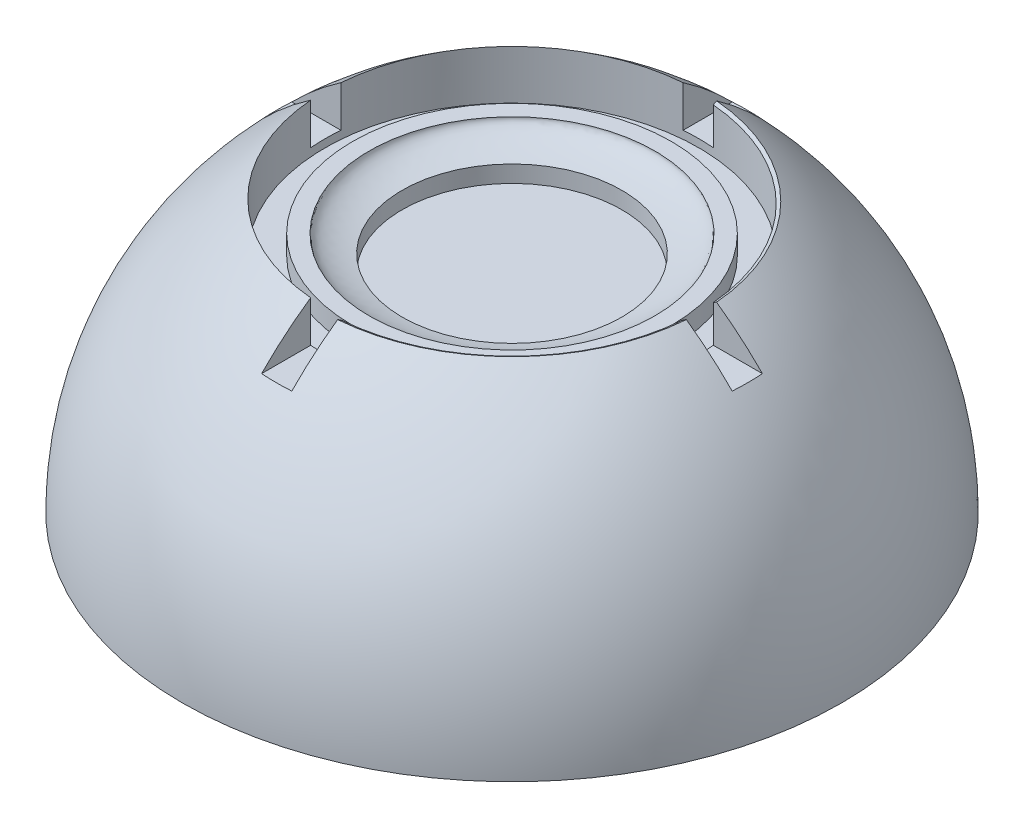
SolidWorks part; units mm, degrees
ref_plane "Front Plane" through (0, 0, 0) normal (0, 0, 1) x (1, 0, 0)
ref_plane "Top Plane" through (0, 0, 0) normal (0, 1, 0) x (1, 0, 0)
ref_plane "Right Plane" through (0, 0, 0) normal (1, 0, 0) x (0, 0, -1)
sketch "Sketch1" plane through (0, 0, 0) normal (0, 0, 1) x (1, 0, 0)
  line L0 (0, 6.1) -> (0, 7.8)
  line L1 (6.1, 0) -> (12, 0)
  line L2 (5.2, 8.8) -> (5.8, 8.8)
  line L3 (0, 12) -> (5.8, 12) construction
  line L4 (0, 9.8) -> (0, 8.8) construction
  line L5 (5.2, 8.8) -> (5.8, 8.8) construction
  line L6 (5.8, 12) -> (5.8, 8.8) construction
  line L7 (5.8, 12) -> (6.8, 12) construction
  line L8 (5.8, 12) -> (5.8, 8.1) construction
  line L9 (5.8, 8.1) -> (6.8, 8.1)
  line L10 (6.8, 12) -> (6.8, 8.1) construction
  line L11 (5.8, 8.8) -> (5.8, 8.1)
  line L12 (6.8, 8.1) -> (6.8, 9.8874)
  line L13 (0, 9.8) -> (0, 12) construction
  line L14 (0, 12) -> (0, 9.8) construction
  line L15 (0, 8.8) -> (5.2, 8.8) construction
  line L16 (0, 8.8) -> (5.2, 8.8) construction
  line L17 (0, 8.8) -> (0, 9.8) construction
  line L18 (0, 7.8) -> (0, 8.8) construction
  arc A1 (12, 0) -> (6.8, 9.8874) centre (0, 0) ccw
  arc A2 (6.1, 0) -> (0, 6.1) centre (0, 0) ccw
  arc A3 (4.677, 11.0511) -> (0, 12) centre (0, 0) ccw construction
  arc A4 (5.8, 10.5052) -> (4.677, 11.0511) centre (0, 0) ccw construction
  arc A5 (6.8, 9.8874) -> (5.8, 10.5052) centre (0, 0) ccw construction
  ellipse E0 centre (0, 8.8) end of major axis (5.2, 8.8) minor radius 1 (0, 9.8) -> (-1.3825, 9.764) ccw construction
  ellipse E1 centre (0, 11.8) end of major axis (5.5, 11.8) minor radius 1.4233 construction
  ellipse E2 centre (0, 8.8) end of major axis (5.2, 8.8) minor radius 1 (0.8821, 9.7855) -> (0, 9.8) ccw construction
  ellipse E3 centre (0, 8.8) end of major axis (5.2, 8.8) minor radius 1 (5.2, 8.8) -> (0.8821, 9.7855) ccw construction
  ellipse E4 centre (0, 8.8) end of major axis (5.2, 8.8) minor radius 1 (-1.3825, 9.764) -> (0, 7.8) ccw construction
  ellipse E5 centre (0, 8.8) end of major axis (5.2, 8.8) minor radius 1 (0, 7.8) -> (5.2, 8.8) ccw
  dimension "D1" = 12
  dimension "D2" = 6.1
  dimension "D3" = 1.4233
  dimension "D4" = 5.5
  dimension "D5" = 11.8
  dimension "D6" = 8.8
  dimension "D7" = 5.8
  dimension "D8" = 3.9
  dimension "D9" = 1
  dimension "D10" = 5.2
  dimension "D11" = 1
revolve "Revolve1" add sketch "Sketch1" angle 360 about L0
sketch "Sketch2" plane through (0, 0, 0) normal (0, -1, 0) x (1, 0, 0)
  circle A0 centre (0, 0) radius 7 construction
  circle A1 centre (7, 0) radius 0.25
  circle A2 centre (0, 7) radius 0.25
  circle A3 centre (-7, 0) radius 0.25
  circle A4 centre (0, -7) radius 0.25
  dimension "D1" = 0.5
  dimension "D2" = 0.5
  dimension "D3" = 0.5
  dimension "D4" = 0.5
  dimension "D5" = 14
sketch "Sketch4" plane through (0, 0, 0) normal (0, -1, 0) x (1, 0, 0)
  circle A0 centre (0, 0) radius 8 construction
  circle A1 centre (0, 8) radius 1.1
  circle A2 centre (8, 0) radius 1.1
  circle A3 centre (0, -8) radius 1.1
  circle A4 centre (-8, 0) radius 1.1
  dimension "D1" = 16
  dimension "D2" = 2.2
  dimension "D3" = 2.2
  dimension "D4" = 2.2
  dimension "D5" = 2.2
extrude "Cut-Extrude1" cut sketch "Sketch4" against normal blind 3
ref_plane "Plane1" through (0, 0, -12.5) normal (0, 0, 1) x (1, 0, 0)
sketch "Sketch5" plane through (0, 0, -12.5) normal (0, 0, 1) x (1, 0, 0)
  line L0 (6.8, 9.8874) -> (-6.8, 9.8874) construction
  line L1 (-0.55, 9.8874) -> (0.55, 9.8874)
  line L2 (-0.55, 9.8874) -> (-0.55, 8.3874)
  line L3 (-0.55, 8.3874) -> (0.55, 8.3874)
  line L4 (0.55, 9.8874) -> (0.55, 8.3874)
  point P6 (0, 9.8874)
  dimension "D1" = 1.1
  dimension "D2" = 1.5
extrude "Cut-Extrude2" cut sketch "Sketch5" along normal blind 6
pattern_circular "CirPattern1" count 4 every 90 about axis through (0, 0, 0) along (0, 1, 0) of "Cut-Extrude2"
chamfer "Chamfer1" distance 0.15 angle 60 2 edges at (4.8083, 9.8874, 4.8083) (4.8083, 9.8874, -4.8083)
chamfer "Chamfer3" distance 0.2 angle 45 1 edges at (6.1, 0, 0)
ref_plane "Plane2" through (0, 10.648, 0) normal (0, 1, 0) x (1, 0, 0)
sketch "Sketch6" plane through (0, 10.648, 0) normal (0, 1, 0) x (1, 0, 0)
  circle A0 centre (0, 0) radius 4
  dimension "D1" = 8
extrude "Cut-Extrude4" cut sketch "Sketch6" against normal blind 3.1
